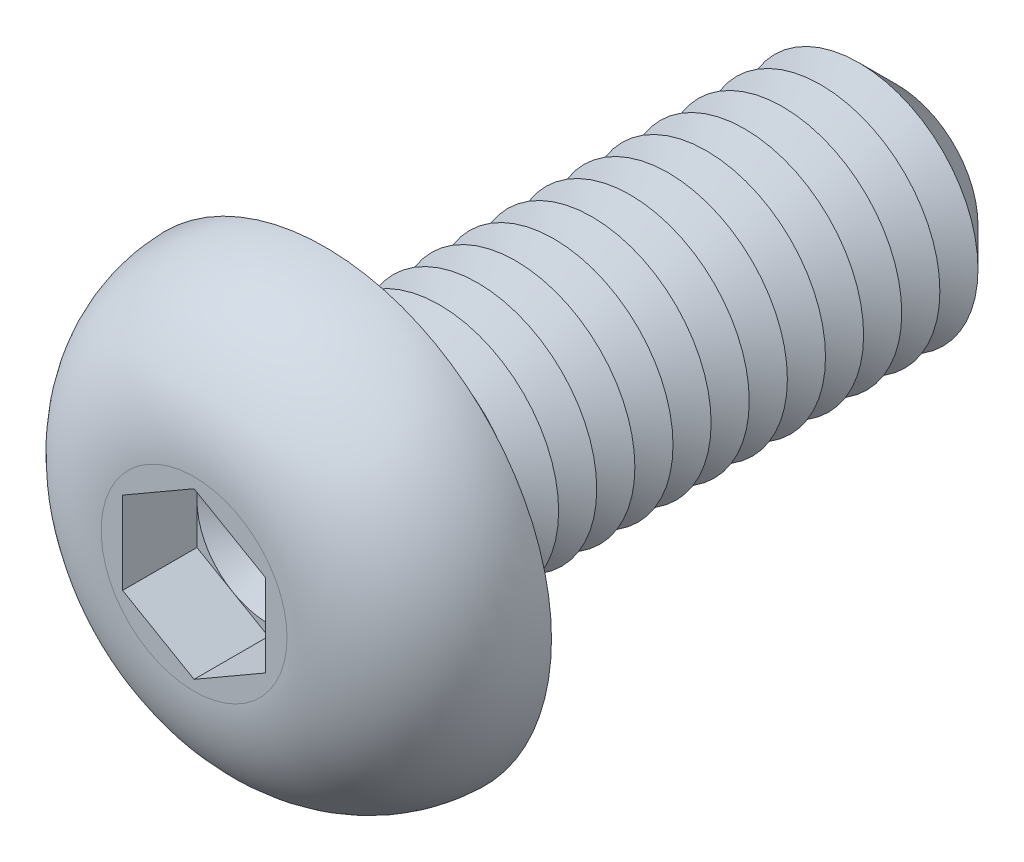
SolidWorks part; units mm, degrees
ref_plane "Front Plane" through (0, 0, 0) normal (0, 0, 1) x (1, 0, 0)
ref_plane "Top Plane" through (0, 0, 0) normal (0, 1, 0) x (1, 0, 0)
ref_plane "Right Plane" through (0, 0, 0) normal (1, 0, 0) x (0, 0, -1)
sketch "Sketch1" plane through (0, 0, 0) normal (1, 0, 0) x (0, 0, -1)
  line L0 (-47.9342, 0) -> (60.3146, 0) construction
sketch "Sketch2" plane through (0, 0, 0) normal (1, 0, 0) x (0, 0, -1)
  line L0 (0, 0) -> (-2.75, 0)
  line L1 (-47.9342, 0) -> (60.3146, 0) construction
  line L2 (-2.75, 0) -> (-2.75, 1.9504)
  line L3 (0, 4.75) -> (0, 0)
  arc A0 (-2.75, 1.9504) -> (0, 4.75) centre (0.05, 1.9504) cw
  dimension "D1" = 2.8
  dimension "D2" = 2.75
  dimension "D3" = 4.75
revolve "Revolve1" add sketch "Sketch2" angle 360 about L0
sketch "Sketch3" plane through (0, 0, 2.75) normal (0, 0, 1) x (1, 0, 0)
  line L1 (0, 1.7321) -> (-1.5, 0.866)
  line L2 (-1.5, 0.866) -> (-1.5, -0.866)
  line L3 (-1.5, -0.866) -> (0, -1.7321)
  line L4 (0, -1.7321) -> (1.5, -0.866)
  line L5 (1.5, -0.866) -> (1.5, 0.866)
  line L6 (1.5, 0.866) -> (0, 1.7321)
  circle A0 centre (0, 0) radius 1.5 construction
  dimension "D1" = 3
extrude "Cut-Extrude1" cut sketch "Sketch3" against normal blind 1.56
sketch "Sketch4" plane through (0, 0, 0) normal (0, 0, -1) x (-1, 0, 0)
  circle A0 centre (0, 0) radius 2.5
  dimension "D1" = 5
extrude "Boss-Extrude1" add sketch "Sketch4" along normal blind 12
chamfer "Chamfer1" distance 0.8 angle 45 1 edges at (-2.5, 0, -12)
sketch "Sketch5" plane through (0, 0, 0) normal (1, 0, 0) x (0, 0, -1)
  line L0 (0.8, 2.5) -> (1.6, 2.5)
  line L1 (11.2, 2.5) -> (0, 2.5) construction
  line L2 (1.6, 2.5) -> (1.2, 1.8072)
  line L3 (1.2, 1.8072) -> (0.8, 2.5)
  line L4 (0, -4.75) -> (0, 4.75) construction
  line L5 (11.2, 2.5) -> (0, 2.5) construction
  dimension "D1" = 0.8
  dimension "D2" = 0.8
revolve "Cut-Revolve1" cut sketch "Sketch5" angle 360 about L0
pattern_linear "LPattern1" count 13 spacing 0.8 along (0, 0, -1) of "Cut-Revolve1"
fillet "Fillet2" radius 0.4 1 edges at (2.5, 0, 0)
sketch "Sketch6" plane through (0, 0, 1.19) normal (0, 0, 1) x (1, 0, 0)
  line L0 (0, -1.7321) -> (1.5, -0.866) construction
  circle A0 centre (0, 0) radius 1.5
extrude "Cut-Extrude2" cut sketch "Sketch6" against normal through all draft 60
